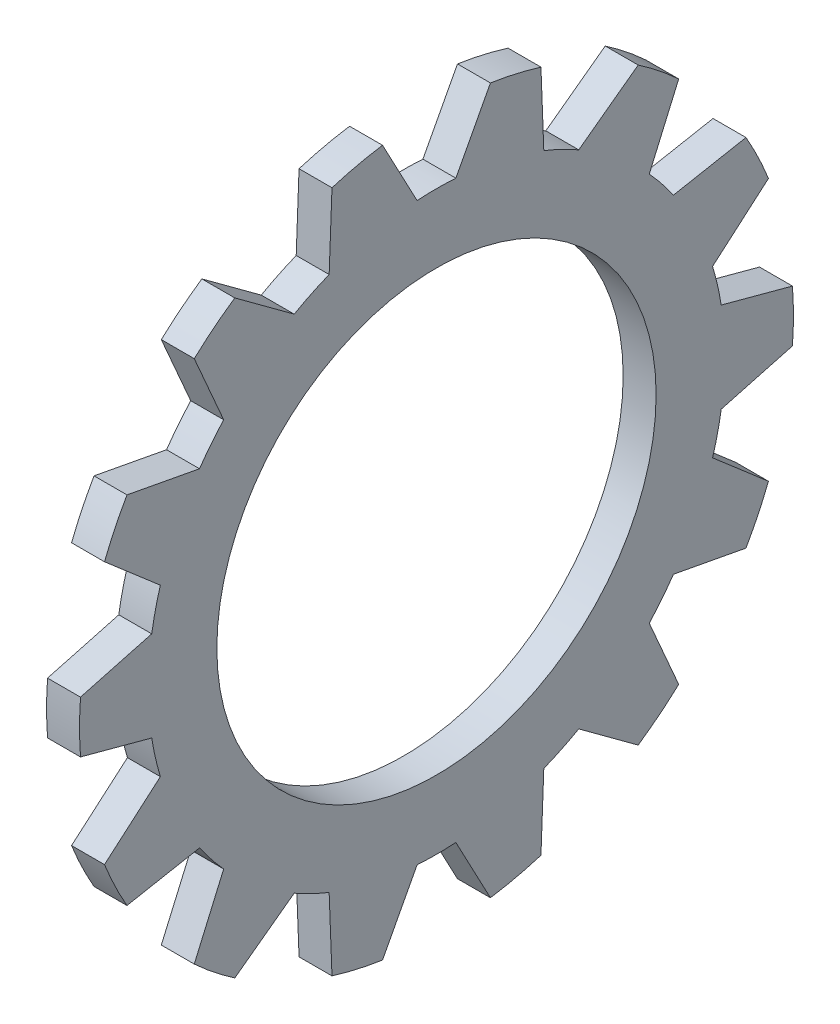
SolidWorks part; units mm, degrees
ref_plane "Plane1" through (0, 0, 0) normal (0, 0, 1) x (1, 0, 0)
ref_plane "Plane2" through (0, 0, 0) normal (0, 1, 0) x (1, 0, 0)
ref_plane "Plane3" through (0, 0, 0) normal (1, 0, 0) x (0, 0, -1)
sketch "SecSke" plane through (0, 0, 0) normal (0, 0, 1) x (1, 0, 0)
  line L0 (-34.925, 0) -> (9.525, 0) construction
  line L1 (0, 8) -> (0, 13)
  line L2 (0, 13) -> (-1.2, 13)
  line L3 (-1.2, 13) -> (-1.2, 8)
  line L4 (-1.2, 8) -> (0, 8)
  dimension "Thickness" = 1.2
  dimension "Inside_dia" = 16
  dimension "Outside_dia" = 26
revolve "Body" add sketch "SecSke" angle 360 about L0
sketch "ExtCutSke" plane through (0, 0, 0) normal (1, 0, 0) x (0, 0, -1)
  line L0 (0, 0) -> (0, 13.65) construction
  line L1 (-2.2865, 13.4571) -> (-0.7063, 10.4762)
  line L2 (2.2865, 13.4571) -> (0.7063, 10.4762)
  arc A0 (2.2865, 13.4571) -> (-2.2865, 13.4571) centre (0, 0) ccw
  arc A1 (0.7063, 10.4762) -> (-0.7063, 10.4762) centre (0, 0) ccw
  dimension "Cut_dia" = 21
  dimension "Clr_dia" = 27.3
  dimension "Cut_ang" = 7.714
  dimension "Clr_ang" = 19.286
extrude "ExtCut" cut sketch "ExtCutSke" against normal through all
pattern_circular "ExtCuts" count 14 every 25.714 about axis through (-34.925, 0, 0) along (1, 0, 0) of "ExtCut"
equation "' \"Inside_dia@SecSke\" = 16"
equation "' \"Outside_dia@SecSke\" = 26"
equation "' \"Thickness@SecSke\" = 1.2"
equation "' \"Count@ExtCuts\" = 14"
equation "' \"Inside_dia@SecSke\" = 10.5"
equation "' \"Outside_dia@SecSke\" = 18"
equation "' \"Thickness@SecSke\" = 0.9"
equation "' \"Count@ExtCuts\" = 12"
equation "' \"Inside_dia@SecSke\" = 6.4"
equation "' \"Outside_dia@SecSke\" = 11"
equation "' \"Thickness@SecSke\" = 0.6"
equation "' \"Inside_dia@SecSke\" = 4.3"
equation "' \"Outside_dia@SecSke\" = 8.5"
equation "' \"Thickness@SecSke\" = 0.45"
equation "' \"Count@ExtCuts\" = 9"
equation "\"Angle@ExtCuts\" = 360 / \"Count@ExtCuts\""
equation "\"Clr_dia@ExtCutSke\" =  \"Outside_dia@SecSke\" * 1.05"
equation "\"Cut_dia@ExtCutSke\" = \"Outside_dia@SecSke\" - (\"Outside_dia@SecSke\"  - \"Inside_dia@SecSke\" ) * 0.5"
equation "\"Clr_ang@ExtCutSke\" = (360 / \"Count@ExtCuts\") * 0.75"
equation "\"Cut_ang@ExtCutSke\" = (360 / \"Count@ExtCuts\") * 0.3"
